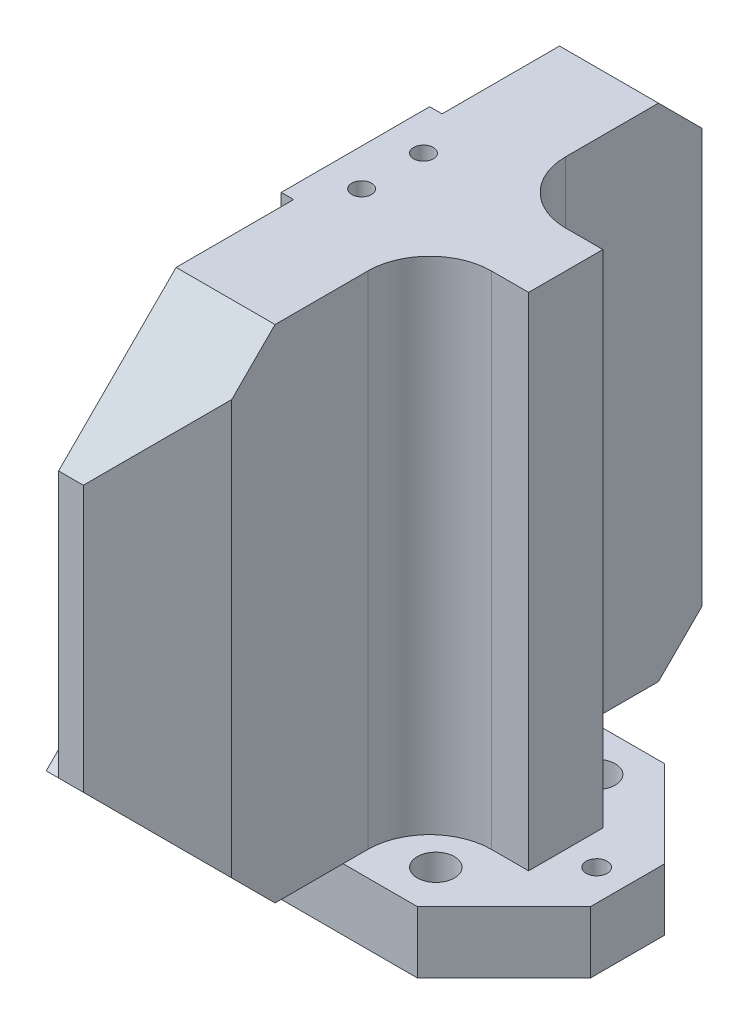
SolidWorks part; units mm, degrees
ref_plane "Спереди" through (0, 0, 0) normal (0, 0, 1) x (1, 0, 0)
ref_plane "Сверху" through (0, 0, 0) normal (0, 1, 0) x (1, 0, 0)
ref_plane "Справа" through (0, 0, 0) normal (1, 0, 0) x (0, 0, -1)
sketch "Эскиз1" plane through (0, 0, 0) normal (1, 0, 0) x (0, 0, -1)
  line L1 (-25, -20) -> (25, -20)
  line L2 (-25, -20) -> (-25, 20)
  line L3 (-25, 20) -> (25, 20)
  line L4 (25, -20) -> (25, 20)
  line L5 (-25, -20) -> (25, 20) construction
  line L6 (-25, 20) -> (25, -20) construction
  point P0 (0, 0)
  dimension "D1" = 50
  dimension "D2" = 40
extrude "Бобышка-Вытянуть1" add sketch "Эскиз1" along normal blind 8
chamfer "Фаска1" distance 9.5 angle 45 2 edges at (4, -20, -25) (4, -20, 25)
sketch "Эскиз2" plane through (0, -20, 0) normal (0, -1, 0) x (-1, 0, 0)
  line L0 (-8, -15.5) -> (-8, 15.5) construction
  line L5 (15, 10) -> (-25, 10)
  line L6 (15, 10) -> (15, -10)
  line L7 (15, -10) -> (-25, -10)
  line L8 (-25, 10) -> (-25, -10)
  line L9 (15, 10) -> (-25, -10) construction
  line L10 (15, -10) -> (-25, 10) construction
  dimension "D1" = 20
  dimension "D2" = 40
  dimension "D3" = 17
extrude "Бобышка-Вытянуть2" add sketch "Эскиз2" along normal blind 5
sketch "Эскиз3" plane through (0, -20, 0) normal (0, 1, 0) x (1, 0, 0)
  line L0 (8, 0) -> (12, 0) construction
  line L1 (8, -10) -> (8, 10) construction
  line L3 (16, 3) -> (8, 3)
  line L4 (16, 3) -> (16, -3)
  line L5 (16, -3) -> (8, -3)
  line L6 (8, 3) -> (8, -3)
  line L7 (16, 3) -> (8, -3) construction
  line L8 (16, -3) -> (8, 3) construction
  dimension "D1" = 4
  dimension "D2" = 6
extrude "Бобышка-Вытянуть3" add sketch "Эскиз3" along normal up to surface (40 mm away)
fillet "Скругление1" radius 5 2 edges at (8, 0, -3) (8, 0, 3)
chamfer "Фаска2" distance 8 angle 45 4 edges at (-15, -22.5, -10) (-15, -22.5, 10) (25, -22.5, -10) (25, -22.5, 10)
sketch "Эскиз4" plane through (0, 0, 0) normal (-1, 0, 0) x (0, 0, 1)
  line L0 (25, -10.5) -> (20.0503, -5.5503)
  line L1 (20.0503, -5.5503) -> (5.6005, -20)
  line L2 (10, -20) -> (-10, -20) construction
  line L3 (-25, -10.5) -> (-20.0503, -5.5503)
  line L4 (-20.0503, -5.5503) -> (-5.6005, -20)
  line L5 (-5.6005, -20) -> (-15.5, -20)
  line L6 (-15.5, -20) -> (-25, -10.5)
  line L7 (5.6005, -20) -> (15.5, -20)
  line L8 (15.5, -20) -> (25, -10.5)
  dimension "D1" = 7
  dimension "D2" = 7
extrude "Бобышка-Вытянуть4" add sketch "Эскиз4" along normal blind 1
sketch "Эскиз5" plane through (0, 0, 0) normal (-1, 0, 0) x (0, 0, 1)
  line L0 (0, 20) -> (0, 16.5) construction
  line L1 (-25, 20) -> (25, 20) construction
  line L3 (-6, 13) -> (6, 13)
  line L4 (-6, 13) -> (-6, 20)
  line L5 (-6, 20) -> (6, 20)
  line L6 (6, 13) -> (6, 20)
  line L7 (-6, 13) -> (6, 20) construction
  line L8 (-6, 20) -> (6, 13) construction
  dimension "D1" = 3.5
  dimension "D2" = 12
extrude "Бобышка-Вытянуть5" add sketch "Эскиз5" along normal blind 1
fillet "Скругление2" radius 10 2 edges at (-0.5, -20, 5.6005) (-0.5, -20, -5.6005)
chamfer "Фаска3" distance 6 angle 45 2 edges at (8, 4.75, -25) (8, 4.75, 25)
sketch "Эскиз6" plane through (0, 20, 0) normal (0, 1, 0) x (1, 0, 0)
  line L0 (-1, 0) -> (2, 0) construction
  line L1 (-1, -6) -> (-1, 6) construction
  line L2 (2, 0) -> (2, 2.5) construction
  circle A0 centre (2, 2.5) radius 0.5
  circle A1 centre (2, -2.5) radius 0.5
  dimension "D3" = 1
  dimension "D1" = 2.5
  dimension "D2" = 3
extrude "Вырез-Вытянуть1" cut sketch "Эскиз6" against normal blind 5
hole_wizard "Отверстие обработанное метчиком M21" positions "Эскиз7" profile "Эскиз8" tap size "M2" standard "ISO"
sketch "Эскиз7" plane through (0, 20, 0) normal (0, 1, 0) x (1, 0, 0)
  point P0 (2, 2.5)
  point P3 (2, -2.5)
sketch "Эскиз8" plane through (2, 20, -2.5) normal (1, 0, 0) x (0, 0, 1)
  line L0 (0, 0) -> (0, 6.4807)
  line L1 (0, 6.4807) -> (0.8, 6)
  line L2 (0.8, 6) -> (0.8, 0)
  line L5 (0.8, 0) -> (0, 0)
  line L10 (0, 6.4807) -> (-0.8, 6) construction
  line L11 (0, -6.35) -> (0, 107.95) construction
  dimension "Диаметр сверла" = 1.6
  dimension "Глубина сверла" = 6
  dimension "Угол заточки сверла" = 118
sketch "Эскиз9" plane through (0, -17.75, -17.75) normal (0, -0.7071, -0.7071) x (-1, 0, 0)
  line L0 (1, -3.182) -> (-2, -3.182) construction
  line L1 (1, -3.182) -> (-8, -3.182) construction
  line L2 (-2, -3.182) -> (-2, 0.818) construction
  line L3 (1, 10.253) -> (1, -3.182) construction
  circle A0 centre (-2, 0.818) radius 0.5
  circle A1 centre (-2, 5.818) radius 0.5
  dimension "D4" = 1
  dimension "D5" = 1
  dimension "D6" = 3
  dimension "D1" = 5
  dimension "D2" = 4
  dimension "D3" = 3
extrude "Вырез-Вытянуть2" cut sketch "Эскиз9" against normal blind 5
hole_wizard "Отверстие обработанное метчиком M22" positions "Эскиз10" profile "Эскиз11" tap size "M2" standard "ISO"
sketch "Эскиз10" plane through (0, -17.75, -17.75) normal (0, -0.7071, -0.7071) x (-1, 0, 0)
  point P0 (-2, 0.818)
  point P3 (-2, 5.818)
sketch "Эскиз11" plane through (2, -17.1716, -18.3284) normal (1, 0, 0) x (0, 0.7071, -0.7071)
  line L0 (0, 0) -> (0, 6.4807)
  line L1 (0, 6.4807) -> (0.8, 6)
  line L2 (0.8, 6) -> (0.8, 0.225)
  line L3 (0.8, 0.225) -> (1.025, 0)
  line L5 (1.025, 0) -> (0, 0)
  line L6 (-0.8, 0.225) -> (-1.025, 0) construction
  line L10 (0, 6.4807) -> (-0.8, 6) construction
  line L11 (0, -6.35) -> (0, 107.95) construction
  dimension "Диаметр сверла" = 1.6
  dimension "Глубина сверла" = 6
  dimension "Диаметр передней зенковки" = 2.05
  dimension "Угол передней зенковки" = 90
  dimension "Угол заточки сверла" = 118
sketch "Эскиз12" plane through (0, -17.75, 17.75) normal (0, -0.7071, 0.7071) x (1, 0, 0)
  line L0 (-1, -3.182) -> (2, -3.182) construction
  line L1 (8, -3.182) -> (-1, -3.182) construction
  line L2 (2, -3.182) -> (2, 0.818) construction
  line L3 (2, 0.818) -> (2, 5.818) construction
  circle A0 centre (2, 0.818) radius 0.5
  circle A1 centre (2, 5.818) radius 0.5
  dimension "D4" = 1
  dimension "D5" = 1
  dimension "D1" = 5
  dimension "D2" = 4
  dimension "D3" = 3
extrude "Вырез-Вытянуть3" cut sketch "Эскиз12" against normal blind 5
hole_wizard "Отверстие обработанное метчиком M23" positions "Эскиз13" profile "Эскиз14" tap size "M2" standard "ISO"
sketch "Эскиз13" plane through (0, -17.75, 17.75) normal (0, -0.7071, 0.7071) x (1, 0, 0)
  point P0 (2, 0.818)
  point P3 (2, 5.818)
sketch "Эскиз14" plane through (2, -17.1716, 18.3284) normal (1, 0, 0) x (0, -0.7071, -0.7071)
  line L0 (0, 0) -> (0, 6.4807)
  line L1 (0, 6.4807) -> (0.8, 6)
  line L2 (0.8, 6) -> (0.8, 0.225)
  line L3 (0.8, 0.225) -> (1.025, 0)
  line L5 (1.025, 0) -> (0, 0)
  line L6 (-0.8, 0.225) -> (-1.025, 0) construction
  line L10 (0, 6.4807) -> (-0.8, 6) construction
  line L11 (0, -6.35) -> (0, 107.95) construction
  dimension "Диаметр сверла" = 1.6
  dimension "Глубина сверла" = 6
  dimension "Диаметр передней зенковки" = 2.05
  dimension "Угол передней зенковки" = 90
  dimension "Угол заточки сверла" = 118
sketch "Эскиз15" plane through (13.5, 0, 13.5) normal (0.7071, 0, 0.7071) x (0.7071, 0, -0.7071)
  circle A0 centre (8.2564, -22.9187) radius 9.8631
extrude "Вырез-Вытянуть4" cut sketch "Эскиз15" against normal blind 2
sketch "Эскиз16" plane through (13.5, 0, -13.5) normal (0.7071, 0, -0.7071) x (-0.7071, 0, -0.7071)
  circle A0 centre (-10.4824, -23.1959) radius 12.5
  dimension "D1" = 25
extrude "Вырез-Вытянуть5" cut sketch "Эскиз16" against normal blind 3
chamfer "Фаска4" distance 3 angle 45 1 edges at (23.4645, -22.5, 0.7071)
sketch "Эскиз17" plane through (0, -20, 0) normal (0, 1, 0) x (1, 0, 0)
  line L0 (16, 0) -> (18.5, 0) construction
  line L1 (16, -3) -> (16, 3) construction
  circle A0 centre (18.5, 0) radius 0.85
  dimension "D2" = 1.7
  dimension "D1" = 2.5
extrude "Вырез-Вытянуть6" cut sketch "Эскиз17" against normal through all
sketch "Эскиз18" plane through (0, -20, 0) normal (0, 1, 0) x (1, 0, 0)
  line L0 (18.5, 0) -> (18.5, 6.5) construction
  line L1 (18.5, 6.5) -> (12, 6.5) construction
  line L2 (18.5, 0) -> (17.8985, 0) construction
  line L3 (12, -6.5) -> (12, 6.5) construction
  line L4 (12, 0) -> (-12, 0) construction
  circle A0 centre (12, 6.5) radius 1.5
  circle A1 centre (12, -6.5) radius 1.5
  circle A2 centre (-12, 0) radius 1.5
  dimension "D3" = 3
  dimension "D5" = 3
  dimension "D1" = 6.5
  dimension "D2" = 6.5
  dimension "D4" = 24
extrude "Вырез-Вытянуть7" cut sketch "Эскиз18" against normal through all
sketch "Эскиз19" plane through (0, -20, 0) normal (0, 1, 0) x (1, 0, 0)
  line L0 (14.1716, -10) -> (22.6645, -10)
  line L1 (22.6645, -10) -> (21.3431, -2.8284)
  line L2 (21.3431, -2.8284) -> (14.1716, -10)
  line L3 (21.3431, 1.4142) -> (12.7574, 10)
  line L4 (12.7574, 10) -> (22.0479, 10)
  line L5 (22.0479, 10) -> (21.3431, 1.4142)
extrude "Бобышка-Вытянуть6" add sketch "Эскиз19" against normal up to surface (5 mm away)
sketch "Эскиз20" plane through (0, -20, 0) normal (0, 1, 0) x (1, 0, 0)
  line L1 (21.3431, -2.8284) -> (27.9899, -2.8284)
  line L2 (21.3431, -2.8284) -> (21.3431, -21.5908)
  line L3 (21.3431, -21.5908) -> (27.9899, -21.5908)
  line L4 (27.9899, -2.8284) -> (27.9899, -21.5908)
  line L5 (21.3431, 1.4142) -> (30.3029, 1.4142)
  line L6 (21.3431, 1.4142) -> (21.3431, 15.1834)
  line L7 (21.3431, 15.1834) -> (30.3029, 15.1834)
  line L8 (30.3029, 1.4142) -> (30.3029, 15.1834)
extrude "Вырез-Вытянуть8" cut sketch "Эскиз20" against normal blind 10
sketch "Эскиз21" plane through (21.3431, 0, 0) normal (1, 0, 0) x (0, 0, -1)
  circle A0 centre (0, -22.9792) radius 25.126
extrude "Вырез-Вытянуть9" cut sketch "Эскиз21" against normal blind 0.34
chamfer "Фаска5" distance 7 angle 45 2 edges at (21.0031, -22.5, -10) (21.0031, -22.5, 10)
sketch "Эскиз22" plane through (0, -20, 0) normal (0, 1, 0) x (1, 0, 0)
  line L0 (-12, 0) -> (-4, 0) construction
  circle A0 centre (-4, 0) radius 2
  dimension "D2" = 4
  dimension "D1" = 8
extrude "Вырез-Вытянуть10" cut sketch "Эскиз22" against normal through all
sketch "Эскиз23" plane through (0, 20, 0) normal (0, 1, 0) x (1, 0, 0)
  line L0 (13, 3) -> (16, 3)
  line L1 (16, 3) -> (16, -3)
  line L2 (16, -3) -> (13, -3)
  line L3 (8, -8) -> (8, -19)
  line L4 (8, -19) -> (2, -25)
  line L5 (2, -25) -> (0, -25)
  line L6 (0, -25) -> (0, -6)
  line L7 (0, -6) -> (-1, -6)
  line L8 (-1, -6) -> (-1, 6)
  line L9 (-1, 6) -> (0, 6)
  line L10 (0, 6) -> (0, 25)
  line L11 (0, 25) -> (2, 25)
  line L12 (2, 25) -> (8, 19)
  line L13 (8, 19) -> (8, 8)
  arc A0 (13, -3) -> (8, -8) centre (13, -8) ccw
  arc A1 (8, 8) -> (13, 3) centre (13, 8) ccw
  circle A2 centre (2, 2.5) radius 0.8
  circle A3 centre (2, -2.5) radius 0.8
extrude "Бобышка-Вытянуть7" add sketch "Эскиз23" along normal blind 0.5
chamfer "Фаска6" distance 9.5 angle 45 2 edges at (1, 20.5, 25) (1, 20.5, -25)
